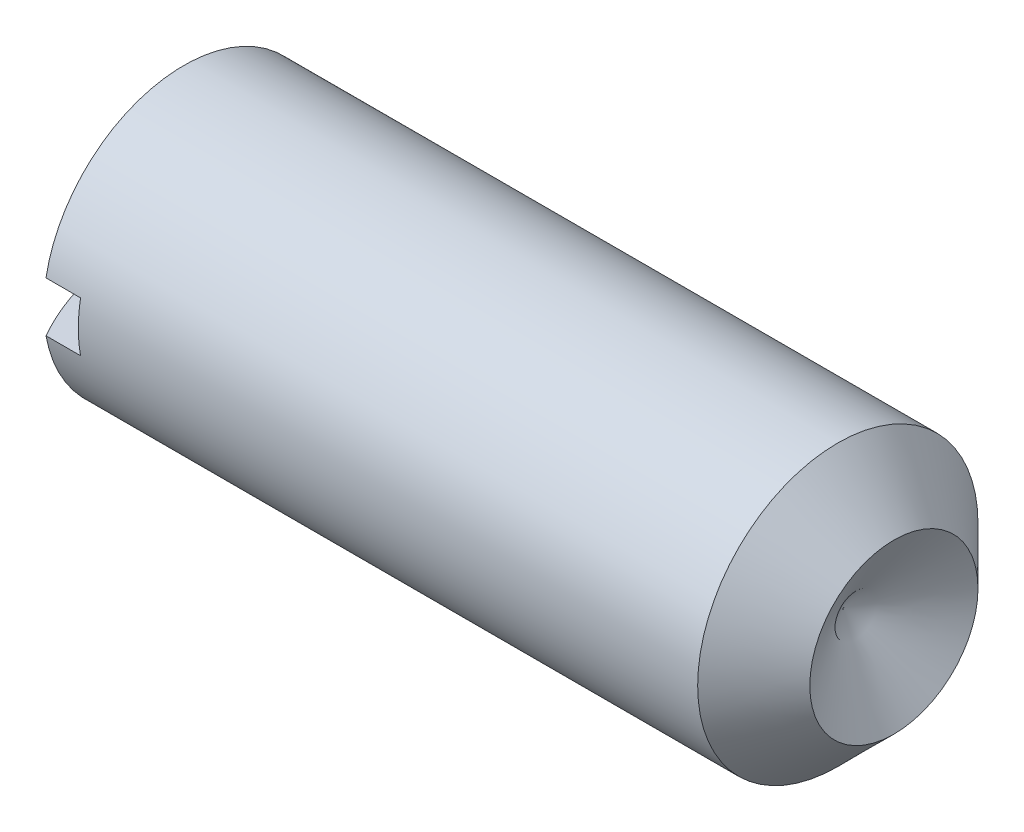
SolidWorks part; units mm, degrees
ref_plane "Plane1" through (0, 0, 0) normal (0, 0, 1) x (1, 0, 0)
ref_plane "Plane2" through (0, 0, 0) normal (0, 1, 0) x (1, 0, 0)
ref_plane "Plane3" through (0, 0, 0) normal (1, 0, 0) x (0, 0, -1)
sketch "BodySke" plane through (0, 0, 0) normal (0, 0, 1) x (1, 0, 0)
  line L0 (2.5522, -9.525) -> (47.1574, -9.525) construction
  line L1 (50.8, -5.715) -> (47.3661, 0) construction
  line L2 (2.5522, 9.525) -> (46.99, 9.525)
  line L3 (50.8, 5.715) -> (46.99, 9.525)
  line L4 (47.3661, 0) -> (0, 0)
  line L5 (-12.7, 0) -> (88.9, 0) construction
  line L6 (50.8, 5.715) -> (50.8, 19.05) construction
  line L7 (50.8, -5.715) -> (46.99, -9.525) construction
  line L8 (50.8, 5.715) -> (47.3661, 0)
  line L9 (2.0066, 12.7) -> (2.0066, -3.175) construction
  arc A1 (2.5522, 9.525) -> (0, 0) centre (19.05, 0) ccw
  dimension "Crown_radius" = 19.05
  dimension "Length" = 50.8
  dimension "Diameter" = 19.05
  dimension "Cup_ang" = 118
  dimension "Cup_dia" = 11.43
  dimension "Nose_ch_ang" = 45
  dimension "Advance" = 2.0066
revolve "BaseBody" add sketch "BodySke" angle 360 about L5
sketch "Sketch2" plane through (0, 0, 0) normal (1, 0, 0) x (0, 0, -1)
  line L1 (9.525, -1.7018) -> (-9.525, -1.7018)
  line L2 (9.525, -1.7018) -> (9.525, 1.7018)
  line L3 (9.525, 1.7018) -> (-9.525, 1.7018)
  line L4 (-9.525, -1.7018) -> (-9.525, 1.7018)
  dimension "D1" = 19.05
  dimension "D2" = 1.7018
  dimension "Slot_width" = 3.4036
  dimension "D3" = 9.525
extrude "Slot" cut sketch "Sketch2" along normal blind 4.9022
sketch "ThdSchSke" plane through (0, 0, 0) normal (0, 0, 1) x (1, 0, 0)
  line L0 (2.5522, -8.0124) -> (1.4931, -9.525)
  line L1 (2.5522, -8.0124) -> (3.6113, -9.525)
  line L2 (3.6113, -9.525) -> (3.6113, -11.9063)
  line L3 (-3.175, 0) -> (5.1513, 0) construction
  line L4 (2.5522, -9.525) -> (2.5522, -1.7018) construction
  line L5 (3.6113, -11.9063) -> (1.4931, -11.9063)
  line L6 (1.4931, -11.9063) -> (1.4931, -9.525)
  dimension "Thread_minor" = 16.0249
  dimension "Diameter" = 19.05
  dimension "SideAngle" = 55
  dimension "VeeAngle" = 70
  dimension "Overcut" = 23.8125
revolve "ThreadSchematic" [suppressed] cut sketch "ThdSchSke" angle 360 about L3
pattern_linear "ThdSchPat" [suppressed]
equation "\"D1@Sketch2\" = \"Diameter@BodySke\""
equation "\"D3@Sketch2\" = \"D1@Sketch2\" / 2"
equation "\"D2@Sketch2\" = \"Slot_width@Sketch2\" / 2"
equation "\"Thread_minor@ThdSchSke\" = \"Thread_minor@ThreadCosmetic\""
equation "\"Diameter@ThdSchSke\" = \"Diameter@BodySke\""
equation "\"Overcut@ThdSchSke\" = \"Diameter@BodySke\" * 1.25"
equation "\"Num_threads@ThdSchPat\" = int ( ( \"Length@BodySke\" - ( \"Crown_radius@BodySke\" - sqr ( ( \"Crown_radius@BodySke\" * \"Crown_radius@BodySke\" ) - ( ( \"Diameter@BodySke\" * 0.5 ) * ( \"Diameter@BodySke\" * 0.5 "
equation "\"Advance@ThdSchPat\" = ( \"Length@BodySke\" - ( \"Crown_radius@BodySke\" - sqr ( ( \"Crown_radius@BodySke\" * \"Crown_radius@BodySke\" ) - ( ( \"Diameter@BodySke\" * 0.5 ) * ( \"Diameter@BodySke\" * 0.5 ) ) ) ) - "
equation "' \"Num_threads@ThdSchPat\" = \"Num_threads@ThdSchPat\" - sgn( \"Num_threads@ThdSchPat\" - 1) '---chamfered tips only---"
